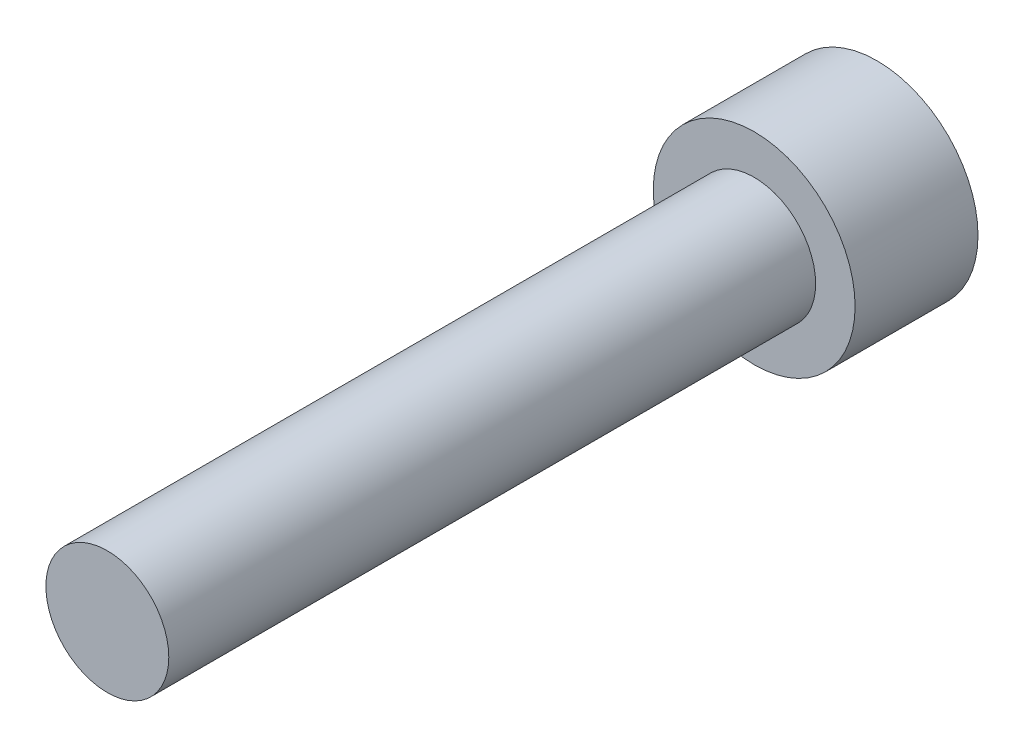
SolidWorks part; units mm, degrees
ref_plane "Front Plane" through (0, 0, 0) normal (0, 0, 1) x (1, 0, 0)
ref_plane "Top Plane" through (0, 0, 0) normal (0, 1, 0) x (1, 0, 0)
ref_plane "Right Plane" through (0, 0, 0) normal (1, 0, 0) x (0, 0, -1)
sketch "Sketch6" plane through (0, 0, 0) normal (1, 0, 0) x (0, 0, -1)
  line L0 (-25.4, 0) -> (22.525, 0) construction
  line L1 (4.3586, 0) -> (-4.3586, 0) construction
  line L2 (-25.4, 0) -> (-25.4, -2.413)
  line L3 (-25.4, -2.413) -> (0, -2.413)
  line L4 (0, 4.3586) -> (0, -4.3586) construction
  line L5 (0, -2.413) -> (0, -3.9624)
  line L6 (0, -3.9624) -> (4.826, -3.9624)
  line L7 (4.826, -3.9624) -> (4.826, 0)
  line L8 (4.826, 0) -> (-25.4, 0)
  dimension "L" = 25.4
  dimension "H" = 4.826
  dimension "A" = 7.9248
  dimension "D" = 4.826
revolve "Revolve1" add sketch "Sketch6" angle 360 about L0
sketch "Sketch7" plane through (0, 0, -4.826) normal (0, 0, -1) x (-1, 0, 0)
  line L2 (-1.9812, 1.1438) -> (-1.9812, -1.1438)
  line L4 (-1.9812, -1.1438) -> (0, -2.2877)
  line L5 (0, -2.2877) -> (1.9812, -1.1438)
  line L6 (1.9812, -1.1438) -> (1.9812, 1.1438)
  line L7 (1.9812, 1.1438) -> (0, 2.2877)
  line L8 (0, 2.2877) -> (-1.9812, 1.1438)
  circle A0 centre (0, 0) radius 1.9812 construction
  dimension "J" = 3.9624
extrude "HEX" cut sketch "Sketch7" against normal blind 3.048
